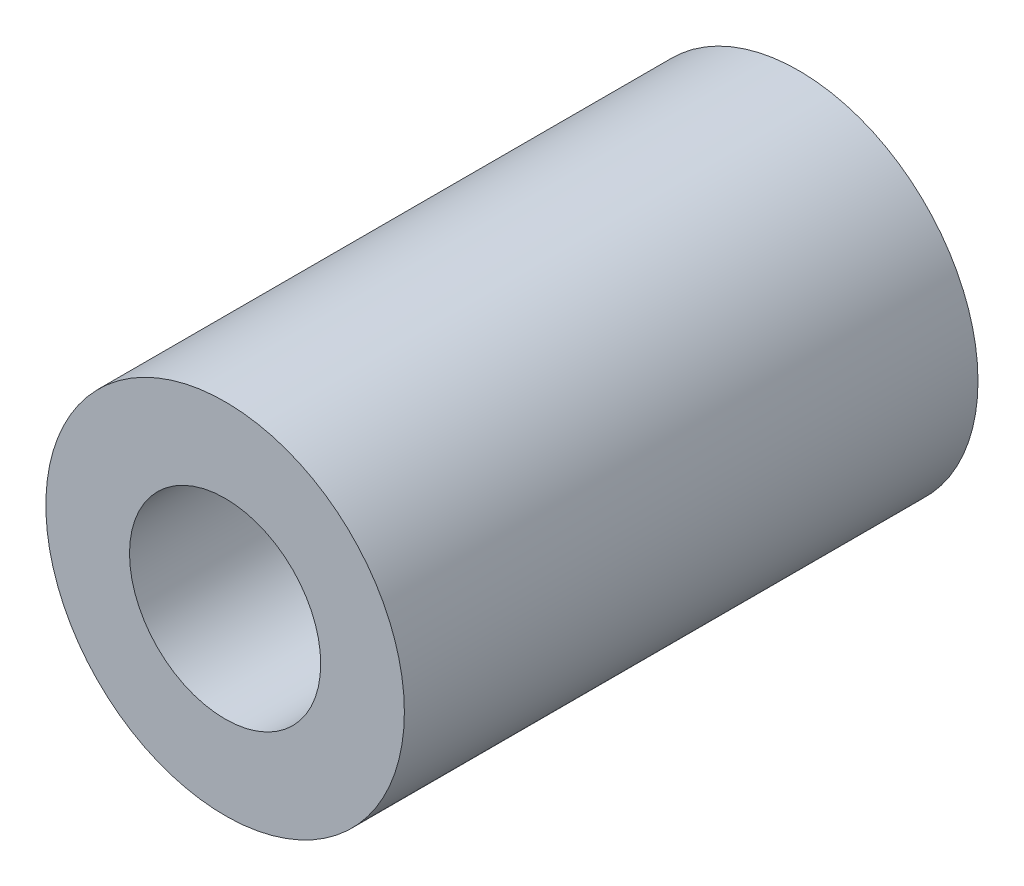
SolidWorks part; units mm, degrees
ref_plane "Alzado" through (0, 0, 0) normal (0, 0, 1) x (1, 0, 0)
ref_plane "Planta" through (0, 0, 0) normal (0, 1, 0) x (1, 0, 0)
ref_plane "Vista lateral" through (0, 0, 0) normal (1, 0, 0) x (0, 0, -1)
sketch "Croquis1" plane through (0, 0, 0) normal (0, 0, 1) x (1, 0, 0)
  circle A0 centre (0, 0) radius 7.5
  circle A1 centre (0, 0) radius 4
  dimension "D1" = 8
  dimension "D2" = 15
extrude "Saliente-Extruir1" add sketch "Croquis1" along normal blind 24
